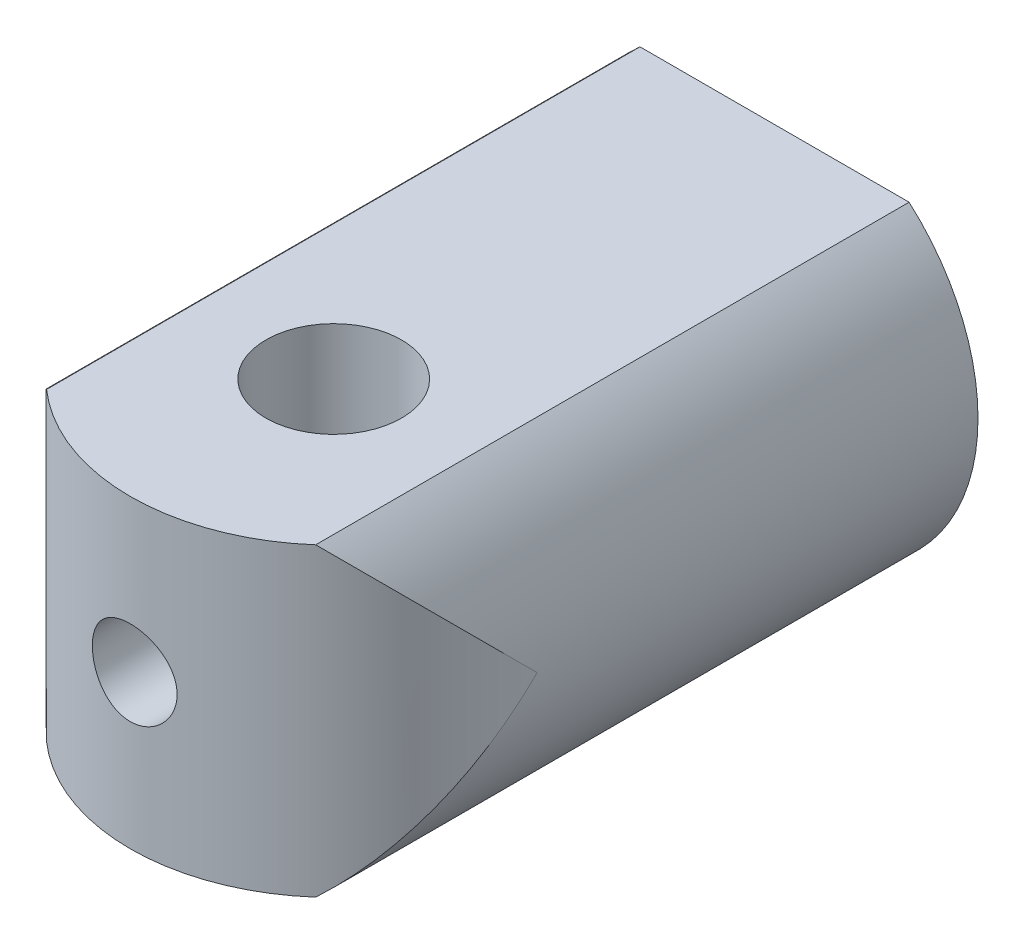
SolidWorks part; units mm, degrees
ref_plane "Plan de face" through (0, 0, 0) normal (0, 0, 1) x (1, 0, 0)
ref_plane "Plan de dessus" through (0, 0, 0) normal (0, 1, 0) x (1, 0, 0)
ref_plane "Plan de droite" through (0, 0, 0) normal (1, 0, 0) x (0, 0, -1)
sketch "Esquisse1" plane through (0, 0, 0) normal (0, 0, 1) x (1, 0, 0)
  circle A0 centre (0, 0) radius 12
  dimension "D1" = 24
extrude "Extrusion1" add sketch "Esquisse1" along normal blind 38
sketch "Esquisse2" plane through (0, 0, 0) normal (0, 1, 0) x (1, 0, 0)
  line L0 (0, 0) -> (0, -118.3386) construction
  line L1 (-12, -38) -> (12, -38) construction
  line L2 (-12, -26) -> (-34.3183, -113.6845)
  line L3 (12, -26) -> (30.9324, -133.3386)
  line L4 (30.9324, -133.3386) -> (33.1115, -137.3246)
  line L5 (33.1115, -137.3246) -> (-13.1735, -135.3316)
  line L6 (-13.1735, -135.3316) -> (-34.3183, -113.6845)
  arc A0 (-12, -26) -> (12, -26) centre (0, -26) ccw
  dimension "D1" = 24
extrude "Enlèv. mat.-Extru.1" cut sketch "Esquisse2" against normal through all and the other way through all
ref_plane "Plan1" through (0, 9, 0) normal (0, 1, 0) x (-1, 0, 0)
sketch "Esquisse3" plane through (0, 9, 0) normal (0, 1, 0) x (-1, 0, 0)
  line L1 (-30.8853, 118.9596) -> (29.4486, 118.9596)
  line L2 (-30.8853, 118.9596) -> (-30.8853, -4.369)
  line L3 (-30.8853, -4.369) -> (29.4486, -4.369)
  line L4 (29.4486, 118.9596) -> (29.4486, -4.369)
ref_plane "Plan2" through (0, -9, 0) normal (0, 1, 0) x (-1, 0, 0)
sketch "Esquisse4" plane through (0, -9, 0) normal (0, 1, 0) x (-1, 0, 0)
  line L1 (52.2218, 116.5729) -> (-46.3488, 116.5729)
  line L2 (52.2218, 116.5729) -> (52.2218, -3.6726)
  line L3 (52.2218, -3.6726) -> (-46.3488, -3.6726)
  line L4 (-46.3488, 116.5729) -> (-46.3488, -3.6726)
extrude "Enlèv. mat.-Extru.3" cut sketch "Esquisse4" against normal through all
hole_wizard "Trou taraudé M81" positions "Esquisse3D1" profile "Esquisse8" tap size "M8" standard "ISO"
sketch3d "Esquisse3D1"
  point P0 (0, 0, 0)
sketch "Esquisse8" plane through (0, 0, 0) normal (1, 0, 0) x (0, 1, 0)
  line L0 (0, 0) -> (0, 18.0429)
  line L1 (0, 18.0429) -> (3.4, 16)
  line L2 (3.4, 16) -> (3.4, 0)
  line L5 (3.4, 0) -> (0, 0)
  line L10 (0, 18.0429) -> (-3.4, 16) construction
  line L11 (0, -6.35) -> (0, 107.95) construction
  dimension "Diamètre du trou pour taraudage" = 6.8
  dimension "Profondeur du trou pour taraudage" = 16
  dimension "Angle de pointe" = 118
ref_plane "Plan5" through (0, 0, 114) normal (0, 0, 1) x (1, 0, 0)
hole_wizard "Trou taraudé M61" positions "Esquisse10" profile "Esquisse9" tap size "M6" standard "ISO"
sketch "Esquisse10" plane through (0, 0, 114) normal (0, 0, 1) x (1, 0, 0)
  point P0 (0, 0)
sketch "Esquisse9" plane through (0, 0, 114) normal (1, 0, 0) x (0, -1, 0)
  line L0 (0, 0) -> (0, 89.5022)
  line L1 (0, 89.5022) -> (2.5, 88)
  line L2 (2.5, 88) -> (2.5, 0)
  line L5 (2.5, 0) -> (0, 0)
  line L10 (0, 89.5022) -> (-2.5, 88) construction
  line L11 (0, -6.35) -> (0, 107.95) construction
  dimension "Diamètre du trou pour taraudage" = 5
  dimension "Profondeur du trou pour taraudage" = 88
  dimension "Angle de pointe" = 118
extrude "Extrusion2" cut sketch "Esquisse3" along normal blind 10
sketch "Esquisse11" plane through (0, 9, 0) normal (0, 1, 0) x (1, 0, 0)
  circle A0 centre (0, -26) radius 4
  dimension "D1" = 8
extrude "Extrusion3" cut sketch "Esquisse11" against normal through all
